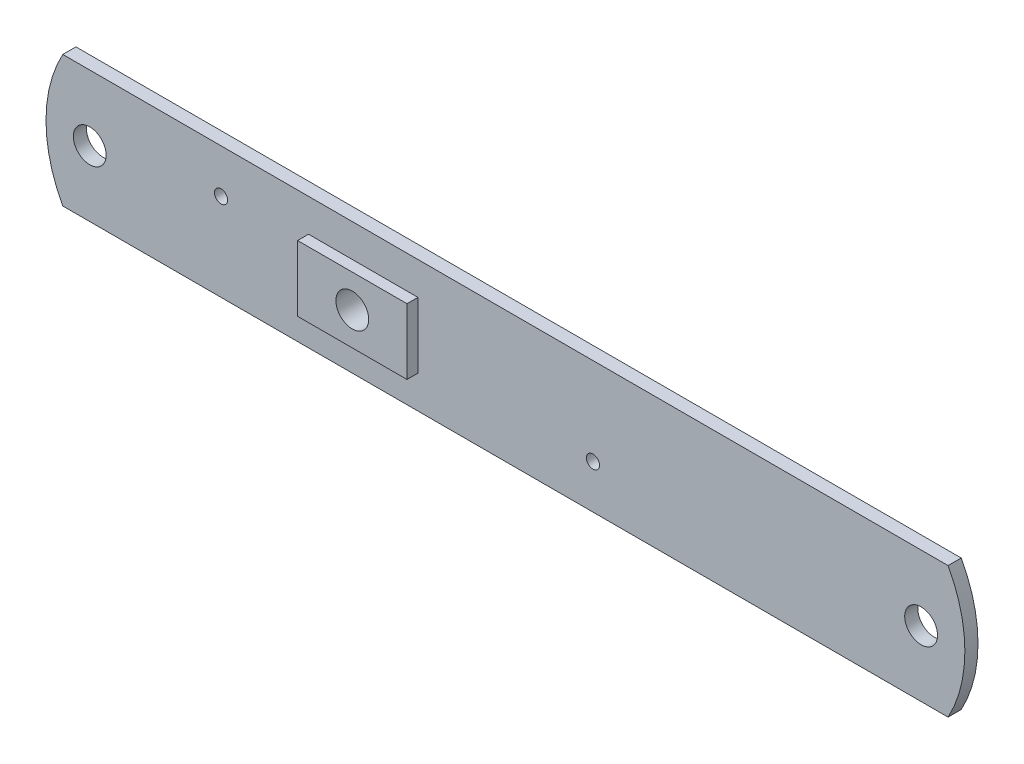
SolidWorks part; units mm, degrees
ref_plane "Plan de face" through (0, 0, 0) normal (0, 0, 1) x (1, 0, 0)
ref_plane "Plan de dessus" through (0, 0, 0) normal (0, 1, 0) x (1, 0, 0)
ref_plane "Plan de droite" through (0, 0, 0) normal (1, 0, 0) x (0, 0, -1)
sketch "Esquisse1" plane through (0, 0, 0) normal (0, 0, 1) x (1, 0, 0)
  line L0 (0, -60) -> (0, 51.89) construction
  line L1 (15.3414, 0) -> (824.6586, 0)
  line L2 (840, -60) -> (840, 141.3895) construction
  line L3 (15.3414, -120) -> (824.6586, -120)
  arc A0 (15.3414, 0) -> (15.3414, -120) centre (125, -60) ccw
  circle A1 centre (40, -60) radius 15
  arc A2 (824.6586, -120) -> (824.6586, 0) centre (715, -60) ccw
  circle A3 centre (160, -40) radius 6
  circle A4 centre (290, -60) radius 15
  circle A5 centre (800, -60) radius 15
  circle A6 centre (500, -80) radius 6
  dimension "D3" = 250
  dimension "D4" = 120
  dimension "D5" = 12
  dimension "D2" = 30
  dimension "D7" = 30
  dimension "D9" = 30
  dimension "D11" = 12
  dimension "D1" = 40
  dimension "D6" = 40
  dimension "D8" = 250
  dimension "D10" = 40
  dimension "D12" = 40
  dimension "D13" = 300
extrude "Extrusion1" add sketch "Esquisse1" along normal blind 12
sketch "Esquisse2" plane through (0, 0, 12) normal (0, 0, 1) x (1, 0, 0)
  line L1 (240, -30) -> (340, -30)
  line L2 (240, -30) -> (240, -90)
  line L3 (240, -90) -> (340, -90)
  line L4 (340, -30) -> (340, -90)
  circle A0 centre (290, -60) radius 15 construction
  dimension "D3" = 50
  dimension "D4" = 30
  dimension "D1" = 100
  dimension "D2" = 60
extrude "Extrusion2" add sketch "Esquisse2" along normal blind 10
sketch "Esquisse3" plane through (0, 0, 22) normal (0, 0, 1) x (1, 0, 0)
  circle A0 centre (290, -60) radius 15
  circle A1 centre (290, -60) radius 15 construction
  dimension "D1" = 30
extrude "Enlèv. mat.-Extru.1" cut sketch "Esquisse3" against normal through all
